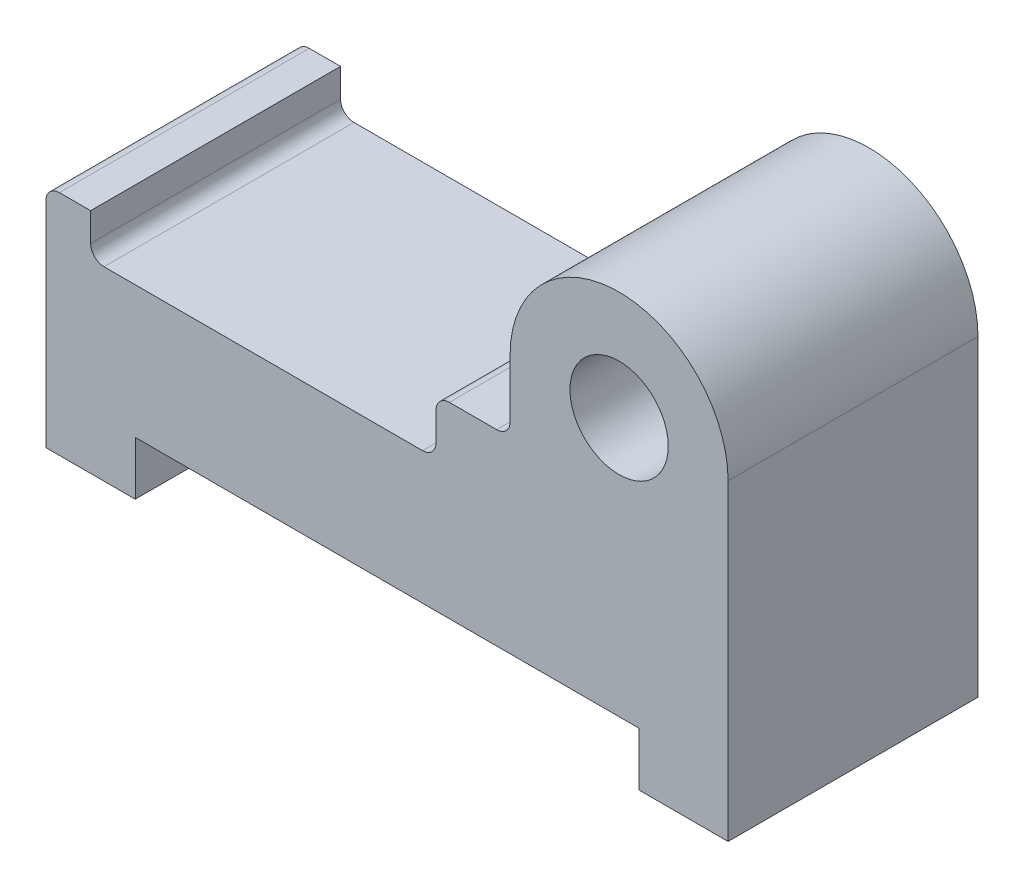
SolidWorks part; units mm, degrees
ref_plane "Front Plane" through (0, 0, 0) normal (0, 0, 1) x (1, 0, 0)
ref_plane "Top Plane" through (0, 0, 0) normal (0, 1, 0) x (1, 0, 0)
ref_plane "Right Plane" through (0, 0, 0) normal (1, 0, 0) x (0, 0, -1)
sketch "Sketch1" plane through (0, 0, 0) normal (0, 0, 1) x (1, 0, 0)
  line L0 (0, 0) -> (20, 0)
  line L1 (20, 0) -> (20, 12)
  line L2 (20, 12) -> (132.8502, 12)
  line L3 (132.8502, 12) -> (132.8502, 0)
  line L4 (132.8502, 0) -> (152.8502, 0)
  line L5 (152.8502, 0) -> (152.8502, 70)
  line L6 (104, 70) -> (104, 57)
  line L7 (101, 54) -> (90.3995, 54)
  line L8 (87.3995, 51) -> (87.3995, 44.6175)
  line L9 (84.3995, 41.6175) -> (13, 41.6175)
  line L10 (10, 44.6175) -> (10, 51)
  line L11 (10, 51) -> (3, 51)
  line L12 (0, 48) -> (0, 0)
  arc A0 (152.8502, 70) -> (104, 70) centre (128.4251, 70) ccw
  arc A1 (104, 57) -> (101, 54) centre (101, 57) cw
  arc A2 (90.3995, 54) -> (87.3995, 51) centre (90.3995, 51) ccw
  arc A3 (87.3995, 44.6175) -> (84.3995, 41.6175) centre (84.3995, 44.6175) cw
  arc A4 (13, 41.6175) -> (10, 44.6175) centre (13, 44.6175) cw
  arc A5 (3, 51) -> (0, 48) centre (3, 48) ccw
  circle A6 centre (128.4251, 70) radius 11.0137
  point P19 (104, 54)
  point P22 (87.3995, 54)
  point P27 (10, 41.6175)
  point P30 (10, 51)
extrude "Extrude1" add sketch "Sketch1" along normal blind 56
